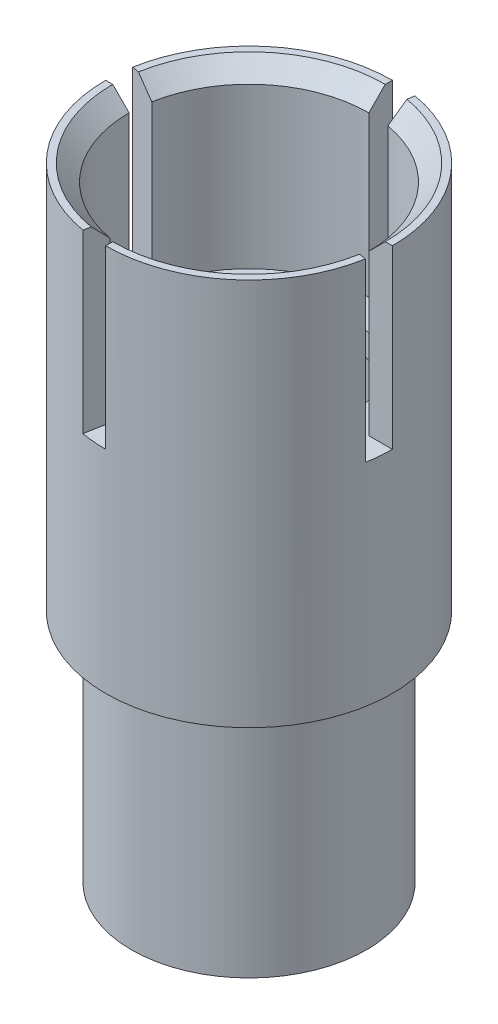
SolidWorks part; units mm, degrees
ref_plane "Front Plane" through (0, 0, 0) normal (0, 0, 1) x (1, 0, 0)
ref_plane "Top Plane" through (0, 0, 0) normal (0, 1, 0) x (1, 0, 0)
ref_plane "Right Plane" through (0, 0, 0) normal (1, 0, 0) x (0, 0, -1)
sketch "Sketch1" plane through (0, 0, 0) normal (0, 1, 0) x (1, 0, 0)
  circle A0 centre (0, 0) radius 12.7
  dimension "D1" = 25.4
extrude "Boss-Extrude1" add sketch "Sketch1" along normal blind 25.4
sketch "Sketch2" plane through (0, 25.4, 0) normal (0, 1, 0) x (1, 0, 0)
  circle A0 centre (0, 0) radius 15.494
  dimension "D1" = 30.988
extrude "Boss-Extrude2" add sketch "Sketch2" along normal blind 41.91
sketch "Sketch3" plane through (0, 67.31, 0) normal (0, 1, 0) x (1, 0, 0)
  circle A0 centre (0, 0) radius 12.954
  dimension "D1" = 25.908
extrude "Cut-Extrude1" cut sketch "Sketch3" against normal blind 19.05
sketch "Sketch4" plane through (0, 0, 0) normal (0, -1, 0) x (1, 0, 0)
  circle A0 centre (0, 0) radius 10.16
  dimension "D1" = 20.32
extrude "Cut-Extrude2" cut sketch "Sketch4" against normal blind 25.4
sketch "Sketch6" plane through (0, 25.4, 0) normal (0, -1, 0) x (1, 0, 0)
  circle A0 centre (0, 0) radius 10.16
extrude "Cut-Extrude3" cut sketch "Sketch6" against normal through all
chamfer "Chamfer1" distance 1.778 angle 45 1 edges at (0, 67.31, 12.954)
sketch "Sketch7" plane through (0, 0, 0) normal (1, 0, 0) x (0, 0, -1)
  line L0 (-12.954, 48.26) -> (-12.954, 72.9495)
  line L1 (-12.954, 48.26) -> (-57.3415, 48.26)
  line L2 (-12.954, 72.9495) -> (-57.3415, 72.9495)
  line L3 (-57.3415, 48.26) -> (-57.3415, 72.9495)
revolve "Cut-Revolve1" cut sketch "Sketch7" angle 10 about axis through (0, 67.31, 0) along (0, -1, 0)
pattern_circular "CirPattern1" count 4 over 360 about axis through (0, 25.4, 0) along (0, -1, 0) of "Cut-Revolve1"
sketch "Sketch8" plane through (0, 0, 0) normal (1, 0, 0) x (0, 0, -1)
  line L0 (10.16, 27.94) -> (10.16, 45.72)
  line L1 (10.16, 27.94) -> (12.7, 27.94)
  line L2 (10.16, 45.72) -> (12.7, 45.72)
  line L3 (12.7, 27.94) -> (12.7, 45.72)
  line L4 (10.16, 0) -> (10.16, 48.26) construction
  line L5 (10.16, 0) -> (10.16, 48.26) construction
  line L6 (-15.494, 25.4) -> (15.494, 25.4) construction
  line L8 (10.16, 48.26) -> (-10.16, 48.26) construction
  dimension "D1" = 2.54
  dimension "D2" = 2.54
  dimension "D3" = 2.54
revolve "Cut-Revolve2" cut sketch "Sketch8" angle 360 about axis through (0, 25.4, 0) along (0, -1, 0)
